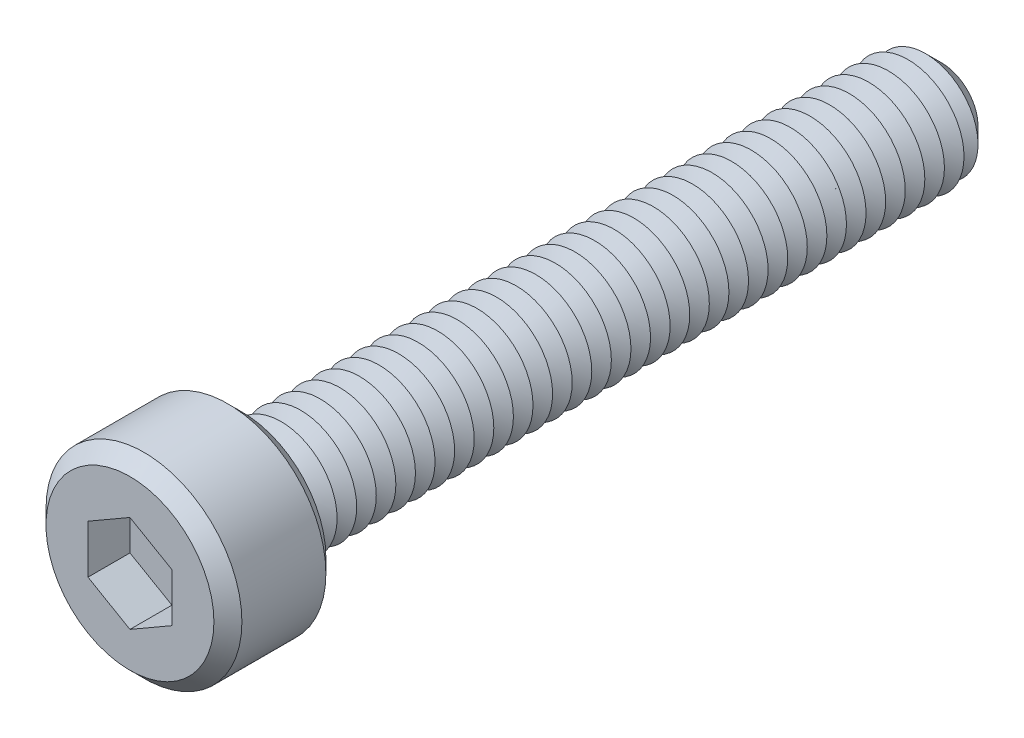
SolidWorks part; units mm, degrees
ref_plane "Front Plane" through (0, 0, 0) normal (0, 0, 1) x (1, 0, 0)
ref_plane "Top Plane" through (0, 0, 0) normal (0, 1, 0) x (1, 0, 0)
ref_plane "Right Plane" through (0, 0, 0) normal (1, 0, 0) x (0, 0, -1)
sketch "Sketch1" plane through (0, 0, 0) normal (0, 0, 1) x (1, 0, 0)
  circle A0 centre (0, 0) radius 3.5
  dimension "D1" = 7
extrude "Boss-Extrude1" add sketch "Sketch1" along normal blind 4
sketch "Sketch2" plane through (0, 0, 0) normal (0, 0, -1) x (-1, 0, 0)
  circle A0 centre (0, 0) radius 2
  dimension "D1" = 4
extrude "Boss-Extrude2" add sketch "Sketch2" along normal blind 25
chamfer "Chamfer1" distance 0.7 angle 45 1 edges at (-2, 0, -25)
sketch "Sketch3" plane through (0, 0, 0) normal (1, 0, 0) x (0, 0, -1)
  line L0 (-2.5121, 0) -> (4.5776, 0) construction
sketch "Sketch4" plane through (0, 0, 0) normal (1, 0, 0) x (0, 0, -1)
  line L0 (0, 2) -> (0.35, 1.3938)
  line L1 (0.35, 1.3938) -> (0.7, 2)
  line L2 (24.3, 2) -> (0, 2) construction
  line L3 (0.7, 2) -> (0, 2)
  dimension "D1" = 0.7
revolve "Cut-Revolve1" cut sketch "Sketch4" angle 360 about L0
pattern_linear "LPattern1" count 35 spacing 0.7 along (0, 0, -1) of "Cut-Revolve1"
sketch "Sketch5" plane through (0, 0, 4) normal (0, 0, 1) x (1, 0, 0)
  line L1 (0, 1.7321) -> (-1.5, 0.866)
  line L2 (-1.5, 0.866) -> (-1.5, -0.866)
  line L3 (-1.5, -0.866) -> (0, -1.7321)
  line L4 (0, -1.7321) -> (1.5, -0.866)
  line L5 (1.5, -0.866) -> (1.5, 0.866)
  line L6 (1.5, 0.866) -> (0, 1.7321)
  circle A0 centre (0, 0) radius 1.5 construction
  dimension "D1" = 3
extrude "Cut-Extrude1" cut sketch "Sketch5" against normal blind 1.5
sketch "Sketch6" plane through (0, 0, 2.5) normal (0, 0, 1) x (1, 0, 0)
  circle A0 centre (0, 0) radius 0.5
  dimension "D1" = 1
extrude "Cut-Extrude2" cut sketch "Sketch6" against normal up to surface (27.5 mm away)
chamfer "Chamfer2" distance 0.5 angle 45 2 edges at (3.5, 0, 0) (3.5, 0, 4)
